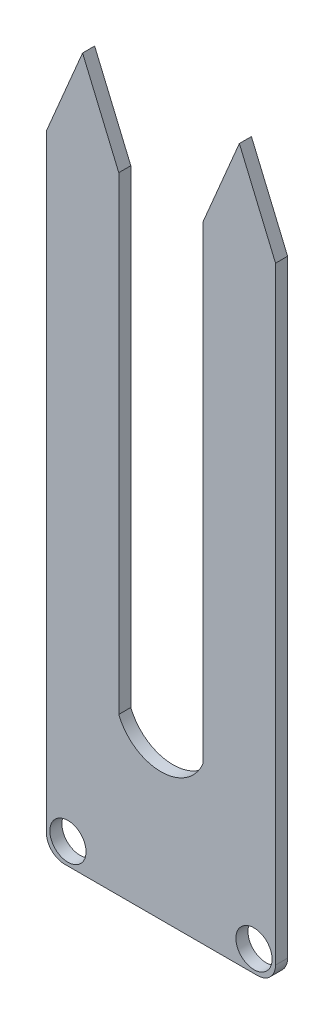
SolidWorks part; units mm, degrees
ref_plane "Front Plane" through (0, 0, 0) normal (0, 0, 1) x (1, 0, 0)
ref_plane "Top Plane" through (0, 0, 0) normal (0, 1, 0) x (1, 0, 0)
ref_plane "Right Plane" through (0, 0, 0) normal (1, 0, 0) x (0, 0, -1)
sketch "Sketch1" plane through (0, 0, 0) normal (0, 0, 1) x (1, 0, 0)
  line L0 (-7.4394, 26.197) -> (-10.4394, 19.1013)
  line L2 (-10.4394, -19.803) -> (-10.4394, -31.303)
  line L3 (-8.9394, -32.803) -> (7.0606, -32.803)
  line L4 (8.5606, -19.803) -> (8.5606, -31.303)
  line L6 (-10.4394, -19.803) -> (-10.4394, 19.1013)
  line L8 (-4.4394, -19.803) -> (-4.4394, 19.1013)
  line L10 (8.5606, -19.803) -> (8.5606, 19.1013)
  line L12 (2.5606, -19.803) -> (2.5606, 19.1013)
  line L14 (-4.4394, 19.1013) -> (-7.4394, 26.197)
  line L15 (5.5606, 26.197) -> (2.5606, 19.1013)
  line L17 (8.5606, 19.1013) -> (5.5606, 26.197)
  line L18 (-0.9394, -32.803) -> (-0.9394, -19.803) construction
  arc A1 (7.0606, -32.803) -> (8.5606, -31.303) centre (7.0606, -31.303) ccw
  arc A2 (-10.4394, -31.303) -> (-8.9394, -32.803) centre (-8.9394, -31.303) ccw
  circle A3 centre (-8.6522, -31.0226) radius 1.5006
  circle A4 centre (6.7734, -31.0226) radius 1.5006
  arc A5 (-4.4394, -19.803) -> (2.5606, -19.803) centre (-0.9394, -18.4006) ccw
  point P17 (-10.4394, -32.803)
  point P24 (6.7734, -31.0226)
  dimension "D3" = 1.5
  dimension "D1" = 13
  dimension "D2" = 19
extrude "Boss-Extrude1" add sketch "Sketch1" along normal blind 1
